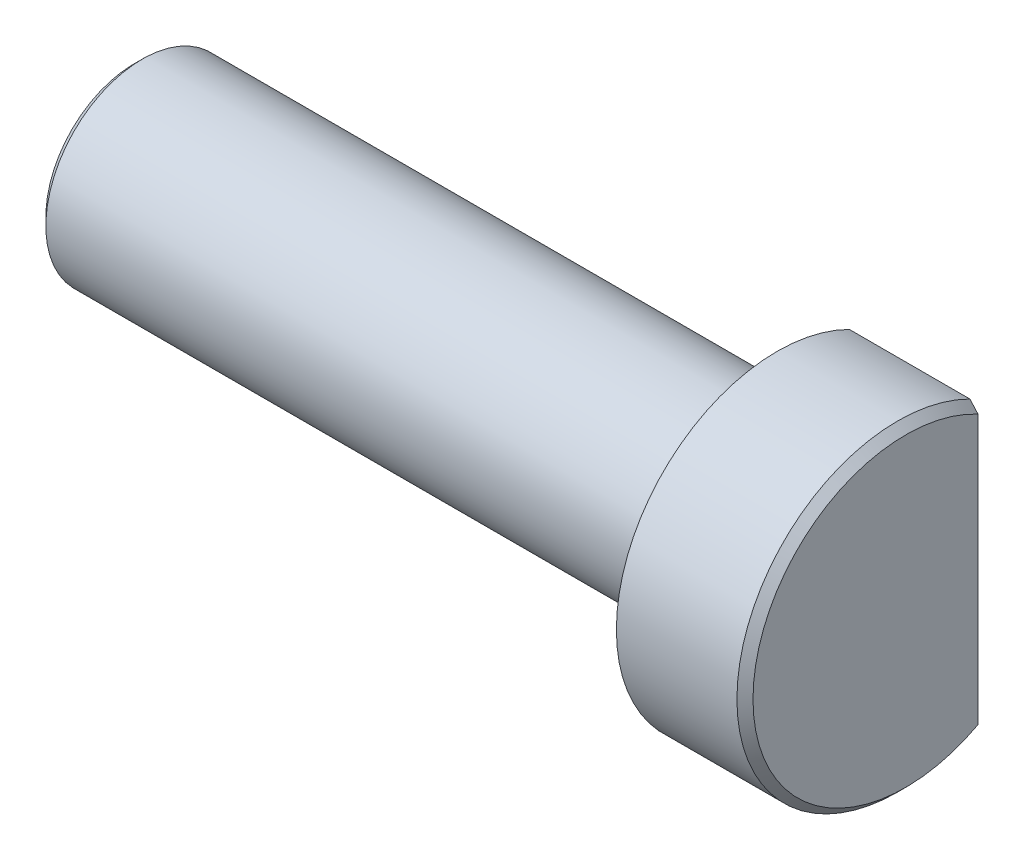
SolidWorks part; units mm, degrees
ref_plane "Plan1" through (0, 0, 0) normal (0, 0, 1) x (1, 0, 0)
ref_plane "Plan2" through (0, 0, 0) normal (0, 1, 0) x (1, 0, 0)
ref_plane "Plan3" through (0, 0, 0) normal (1, 0, 0) x (0, 0, -1)
sketch "Esquisse1" plane through (0, 0, 0) normal (0, 0, 1) x (1, 0, 0)
  line L0 (-100, 0) -> (100, 0) construction
  line L1 (-60, 0) -> (-60, 6)
  line L2 (-60, 6) -> (-20, 6)
  line L3 (-20, 6) -> (-20, 10)
  line L4 (-20, 10) -> (-12, 10)
  line L5 (-12, 10) -> (-12, 0)
  line L6 (-60, 0) -> (-12, 0)
  dimension "D1" = 40
  dimension "D2" = 8
  dimension "D3" = 6
  dimension "D4" = 10
revolve "Base-Révolution" add sketch "Esquisse1" angle 360 about L0
sketch "Esquisse2" plane through (-12, 0, 0) normal (1, 0, 0) x (0, 0, -1)
  line L0 (4.5, 8.9303) -> (4.5, -8.9303)
  arc A0 (4.5, -8.9303) -> (4.5, 8.9303) centre (0, 0) ccw
  circle A1 centre (0, 0) radius 10 construction
  dimension "D1" = 4.5
extrude "Enlèv. mat.-Extru.1" cut sketch "Esquisse2" against normal blind 9.5
fillet "Congé2" radius 1.5 1 edges at (-21.5, 0, -4.5)
chamfer "Chanfrein1" distance 0.5 angle 45 2 edges at (-12, 0, 10) (-60, 0, 6)
